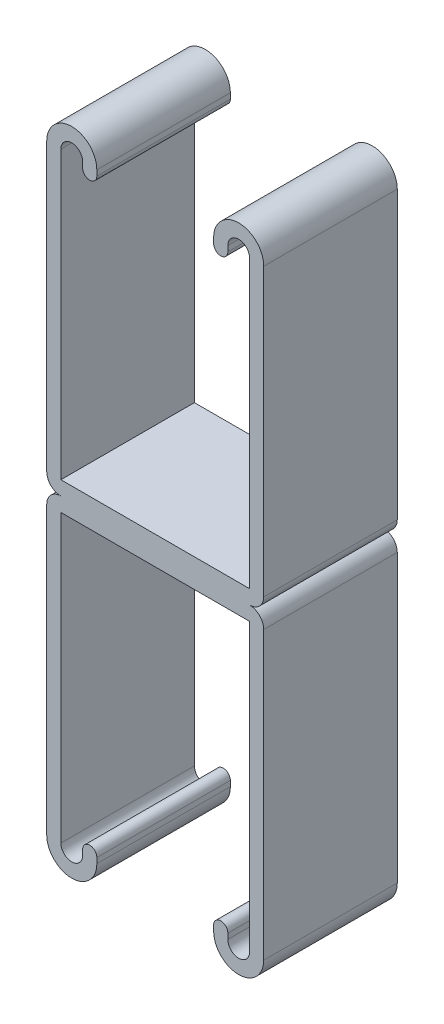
SolidWorks part; units mm, degrees
ref_plane "Plane1" through (0, 0, 0) normal (0, 0, 1) x (1, 0, 0)
ref_plane "Plane2" through (0, 0, 0) normal (0, 1, 0) x (1, 0, 0)
ref_plane "Plane3" through (0, 0, 0) normal (1, 0, 0) x (0, 0, -1)
sketch "Sketch1" plane through (0, 0, 0) normal (0, 0, 1) x (1, 0, 0)
  line L0 (-20.6375, 57.15) -> (-20.6375, 2.6924)
  line L1 (-17.9451, 0) -> (17.9451, 0)
  line L2 (20.6375, 2.6924) -> (20.6375, 57.15)
  line L3 (11.1125, 57.15) -> (11.1125, 56.1149)
  line L4 (-11.1125, 57.15) -> (-11.1125, 56.1149)
  line L5 (-13.8049, 57.15) -> (-13.8049, 56.1149)
  line L6 (-17.9451, 57.15) -> (-17.9451, 2.6924)
  line L7 (-17.9451, 2.6924) -> (17.9451, 2.6924)
  line L8 (17.9451, 2.6924) -> (17.9451, 57.15)
  line L9 (13.8049, 57.15) -> (13.8049, 56.1149)
  line L10 (-25.4, 61.9125) -> (25.4, 61.9125) construction
  line L11 (-12.8524, 54.7687) -> (12.8524, 54.7687) construction
  arc A0 (20.6375, 57.15) -> (11.1125, 57.15) centre (15.875, 57.15) ccw
  arc A1 (-20.6375, 57.15) -> (-11.1125, 57.15) centre (-15.875, 57.15) cw
  arc A2 (-17.9451, 0) -> (-20.6375, 2.6924) centre (-17.9451, 2.6924) cw
  arc A3 (17.9451, 0) -> (20.6375, 2.6924) centre (17.9451, 2.6924) ccw
  arc A4 (-17.9451, 57.15) -> (-13.8049, 57.15) centre (-15.875, 57.15) cw
  arc A5 (17.9451, 57.15) -> (13.8049, 57.15) centre (15.875, 57.15) ccw
  arc A6 (11.1125, 56.1149) -> (13.8049, 56.1149) centre (12.4587, 56.1149) ccw
  arc A7 (-11.1125, 56.1149) -> (-13.8049, 56.1149) centre (-12.4587, 56.1149) cw
  dimension "D1" = 2.6924
  dimension "Width" = 41.275
  dimension "D6" = 9.525
  dimension "D7" = 22.225
  dimension "D9" = 7.1437
  dimension "D2" = 61.9125
  dimension "gauge" = 2.6924
extrude "Base-Extrude" add sketch "Sketch1" along normal mid plane 25.4
mirror "Mirror1" about plane through (0, 0, 0) normal (0, 1, 0) of "Base-Extrude"
equation "\"D7@Sketch1\" = \"Width@Sketch1\" - 2 * \"D6@Sketch1\""
equation "\"D1@Sketch1\" = \"gauge@Sketch1\""
